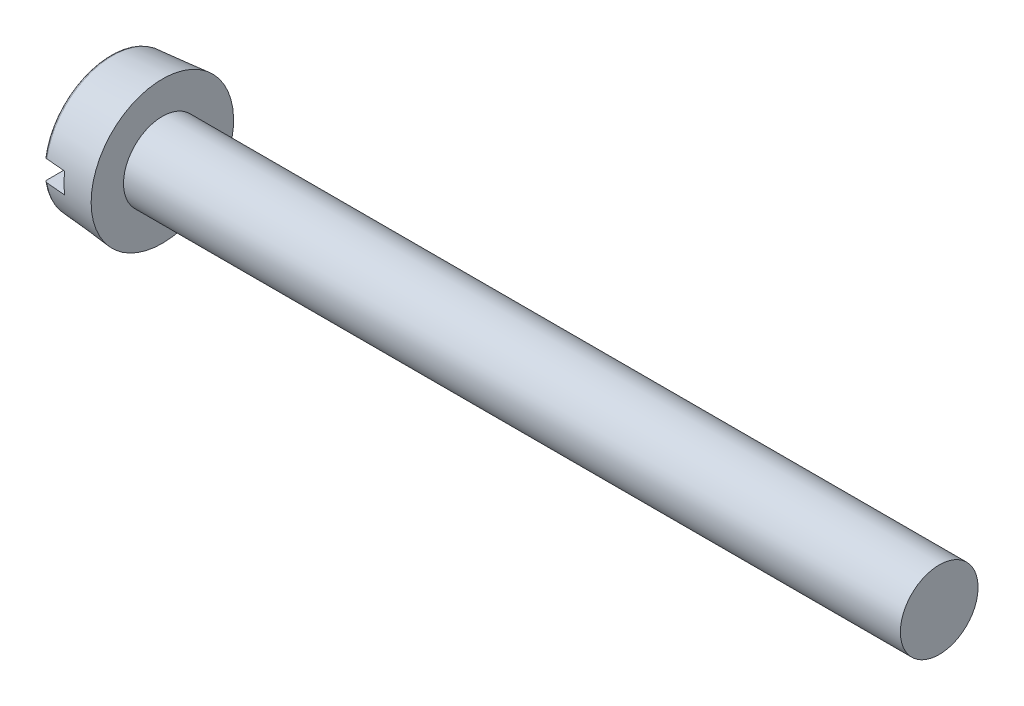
SolidWorks part; units mm, degrees
ref_plane "Plane1" through (0, 0, 0) normal (0, 0, 1) x (1, 0, 0)
ref_plane "Plane2" through (0, 0, 0) normal (0, 1, 0) x (1, 0, 0)
ref_plane "Plane3" through (0, 0, 0) normal (1, 0, 0) x (0, 0, -1)
sketch "BodySke" plane through (0, 0, 0) normal (0, 0, 1) x (1, 0, 0)
  line L0 (2, 1.5) -> (2, 2.75)
  line L1 (0, 0) -> (0, 2.575)
  line L2 (-25.4, 0) -> (127, 0) construction
  line L3 (32, 0) -> (0, 0)
  line L4 (2, 1.5) -> (32, 1.5)
  line L5 (32, 1.5) -> (32, 0)
  line L6 (0, 2.575) -> (2, 2.75)
  line L9 (2.5, 3.0875) -> (2.5, -6.4375) construction
  line L10 (2, 6.35) -> (2, -3.175) construction
revolve "Base-Revolve" add sketch "BodySke"
fillet "Fillet1" [suppressed] radius 0.1
fillet "Fillet2" radius 0.1 1 edges at (0, 0, 2.575)
sketch "Sketch2" plane through (0, 0, 0) normal (1, 0, 0) x (0, 0, -1)
  line L0 (2.75, -0.4) -> (-2.75, -0.4)
  line L1 (2.75, -0.4) -> (2.75, 0.4)
  line L2 (-2.75, 0.4) -> (2.75, 0.4)
  line L3 (-2.75, 0.4) -> (-2.75, -0.4)
extrude "Slot" cut sketch "Sketch2" along normal blind 0.85
sketch "ThdSchSke" plane through (0, 0, 0) normal (0, 0, 1) x (1, 0, 0)
  line L0 (3, -1.2195) -> (2.8036, -1.5)
  line L1 (3, -1.2195) -> (3.1964, -1.5)
  line L2 (3.1964, -1.5) -> (3.1964, -1.875)
  line L3 (-3.175, 0) -> (5.1513, 0) construction
  line L5 (3.1964, -1.875) -> (2.8036, -1.875)
  line L6 (2.8036, -1.875) -> (2.8036, -1.5)
revolve "ThreadSchematic" [suppressed] cut sketch "ThdSchSke" angle 360 about L3
pattern_linear "ThdSchPat" [suppressed]
equation "\"D1@Sketch2\" = \"Head_dia@BodySke\""
equation "\"D2@Sketch2\" = \"D1@Sketch2\" / 2"
equation "\"D3@Sketch2\" = \"Slot_width@Sketch2\" / 2"
equation "\"Thread_length@ThreadCosmetic\" = ((sgn( (\"Length@BodySke\" - \"Advance@BodySke\" * 2.0 ) - \"Thread_nom@BodySke\" )-1)*( (\"Length@BodySke\" - \"Advance@BodySke\"  * 2.0) - \"Thread_nom@BodySke\" ))/-2+ \"Thread_"
equation "\"Thread_minor@ThdSchSke\" = \"Thread_minor@ThreadCosmetic\""
equation "\"Diameter@ThdSchSke\" = \"Diameter@BodySke\""
equation "\"Overcut@ThdSchSke\" = \"Diameter@BodySke\" * 1.25"
equation "\"Start@ThdSchSke\" = \"Head_ht@BodySke\" + \"Length@BodySke\" - \"Thread_length@ThreadCosmetic\"  '---Non-countersunk---"
equation "\"Num_threads@ThdSchPat\" = int( \"Thread_length@ThreadCosmetic\" / \"Advance@BodySke\" + 0.999 )  + 1"
equation "\"Advance@ThdSchPat\" = \"Thread_length@ThreadCosmetic\" /  (\"Num_threads@ThdSchPat\" - 1) 'relax it"
